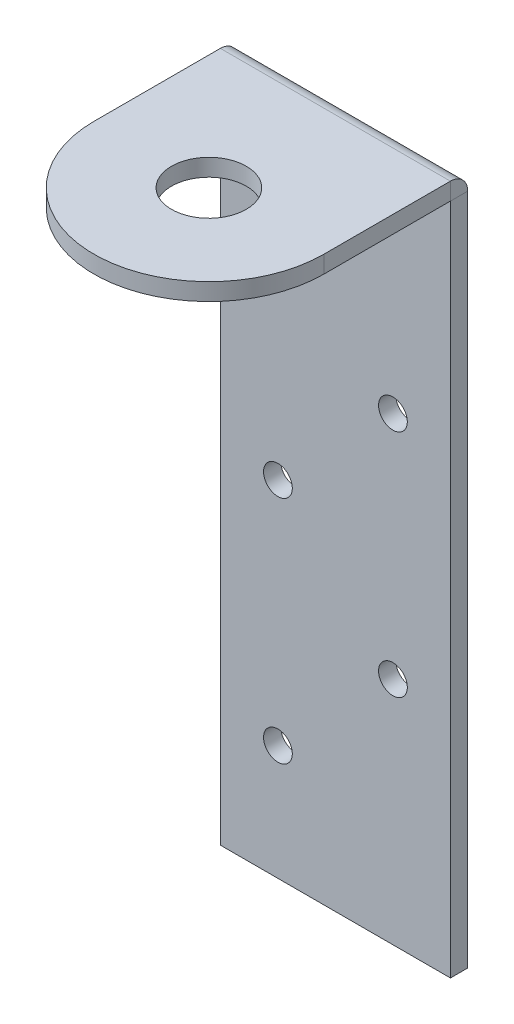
SolidWorks part; units mm, degrees
ref_plane "Front" through (0, 0, 0) normal (0, 0, 1) x (1, 0, 0)
ref_plane "Top" through (0, 0, 0) normal (0, 1, 0) x (1, 0, 0)
ref_plane "Right" through (0, 0, 0) normal (1, 0, 0) x (0, 0, -1)
sketch "Sketch1" plane through (0, 0, 0) normal (0, 0, 1) x (1, 0, 0)
  line L1 (0, 0) -> (40, 0)
  line L2 (0, 0) -> (0, 145)
  line L4 (40, 0) -> (40, 145)
  arc A0 (40, 145) -> (0, 145) centre (20, 145) ccw
  circle A1 centre (20, 145) radius 6.5
  circle A2 centre (10, 20) radius 2.5
  circle A3 centre (30, 40) radius 2.5
  circle A4 centre (10, 60) radius 2.5
  circle A5 centre (30, 80) radius 2.5
sheet metal parameters "Sheet-Metal1" thickness 3 parameters "D1"=0.01
base flange "Base-Flange1" sketch "Sketch1" thickness 3 reverse thickness direction yes parameters "D1"=0.01
sketch "Sketch4" plane through (0, 0, 3) normal (0, 0, 1) x (1, 0, 0)
  line L1 (0, 120) -> (40, 120)
sketched bend "Sketched Bend1" parameters "D1"=0.01
bend "SketchBend1" bend radius 0.01 bend angle 90 parameters "D5"=1
flat pattern "Flat-Pattern1"
sketch "Bend-Lines1" plane through (0, 0, 3) normal (0, 0, 1) x (1, 0, 0)
  line L0 (40, 120) -> (0, 120) construction
bend of the flat pattern "Flatten-<SketchBend1>1"
